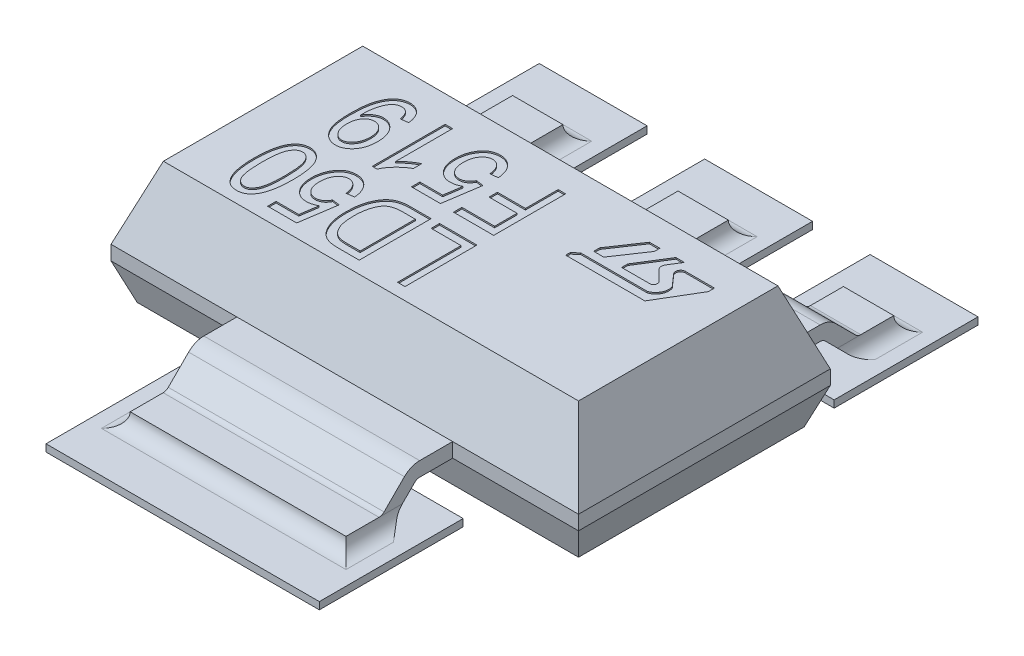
SolidWorks part; units mm, degrees
ref_plane "Plan de face" through (0, 0, 0) normal (0, 0, 1) x (1, 0, 0)
ref_plane "Plan de dessus" through (0, 0, 0) normal (0, 1, 0) x (1, 0, 0)
ref_plane "Plan de droite" through (0, 0, 0) normal (1, 0, 0) x (0, 0, -1)
sketch "Esquisse1" plane through (0, 0, 0) normal (0, 1, 0) x (1, 0, 0)
  line L1 (-3.25, 1.75) -> (3.25, 1.75)
  line L2 (-3.25, 1.75) -> (-3.25, -1.75)
  line L3 (-3.25, -1.75) -> (3.25, -1.75)
  line L4 (3.25, 1.75) -> (3.25, -1.75)
  point P4 (-3.25, 0)
  point P6 (0, -1.75)
  dimension "D1" = 3.5
  dimension "D2" = 6.5
extrude "Boss.-Extru.1" add sketch "Esquisse1" along normal blind 0.2
sketch "Esquisse2" plane through (3.25, 0, 0) normal (1, 0, 0) x (0, 0, -1)
  line L0 (-1.75, 0) -> (-1.568, -0.5)
  line L1 (-1.568, -0.5) -> (1.568, -0.5)
  line L2 (1.568, -0.5) -> (1.75, 0)
  line L3 (1.75, 0) -> (-1.75, 0)
  line L4 (-1.75, 0.2) -> (-1.386, 1.2)
  line L5 (-1.386, 1.2) -> (1.386, 1.2)
  line L6 (1.386, 1.2) -> (1.75, 0.2)
  line L7 (1.75, 0.2) -> (-1.75, 0.2)
  dimension "D1" = 0.5
  dimension "D2" = 1
  dimension "D3" = 70
  dimension "D4" = 70
extrude "Boss.-Extru.2" add sketch "Esquisse2" against normal up to surface (6.5 mm away)
sketch "Esquisse4" plane through (0, 0, -1.75) normal (0, 0, -1) x (-1, 0, 0)
  line L0 (-3.25, 0.2) -> (-2.886, 1.2)
  line L1 (3.25, 1.2) -> (-3.25, 1.2) construction
  line L2 (-2.886, 1.2) -> (-3.25, 1.2)
  line L3 (-3.25, 1.2) -> (-3.25, 0.2)
  line L4 (-3.25, 0) -> (-3.25, -0.5)
  line L5 (-3.25, -0.5) -> (-3.068, -0.5)
  line L6 (3.25, -0.5) -> (-3.25, -0.5) construction
  line L7 (-3.068, -0.5) -> (-3.25, 0)
  line L8 (-3.25, 0.2) -> (3.25, 0.2) construction
  line L9 (-3.25, 0) -> (3.25, 0) construction
  line L10 (3.25, 0.2) -> (2.886, 1.2)
  line L11 (2.886, 1.2) -> (3.25, 1.2)
  line L12 (3.25, 1.2) -> (3.25, 0.2)
  line L13 (3.25, 0) -> (3.25, -0.5)
  line L14 (3.25, -0.5) -> (3.068, -0.5)
  line L15 (3.068, -0.5) -> (3.25, 0)
  dimension "D1" = 70
  dimension "D2" = 70
  dimension "D3" = 70
  dimension "D4" = 70
extrude "Enlèv. mat.-Extru.1" cut sketch "Esquisse4" against normal through all
sketch "Esquisse5" plane through (0, 0, -1.75) normal (0, 0, -1) x (-1, 0, 0)
  line L0 (-3.25, 0.2) -> (3.25, 0.2) construction
  line L1 (-2.65, 0.2) -> (-1.95, 0.2)
  line L2 (-2.65, 0.2) -> (-2.65, 0)
  line L3 (-2.65, 0) -> (-1.95, 0)
  line L4 (-1.95, 0.2) -> (-1.95, 0)
  line L5 (-3.25, 0) -> (3.25, 0) construction
  line L7 (2.65, 0.2) -> (1.95, 0.2)
  line L8 (2.65, 0.2) -> (2.65, 0)
  line L9 (2.65, 0) -> (1.95, 0)
  line L10 (1.95, 0.2) -> (1.95, 0)
  line L11 (0.35, 0.2) -> (-0.35, 0.2)
  line L12 (0.35, 0.2) -> (0.35, 0)
  line L13 (0.35, 0) -> (-0.35, 0)
  line L14 (-0.35, 0.2) -> (-0.35, 0)
  point P16 (0, 0.2)
  dimension "D1" = 0.7
  dimension "D2" = 1.6
  dimension "D3" = 1.6
extrude "Boss.-Extru.3" add sketch "Esquisse5" along normal blind 0.5
sketch "Esquisse6" plane through (0, 0, 1.75) normal (0, 0, 1) x (1, 0, 0)
  line L0 (-3.25, 0.2) -> (3.25, 0.2) construction
  line L1 (-1.5, 0.2) -> (1.5, 0.2)
  line L2 (-1.5, 0.2) -> (-1.5, 0)
  line L3 (-1.5, 0) -> (1.5, 0)
  line L4 (1.5, 0.2) -> (1.5, 0)
  line L5 (-3.25, 0) -> (3.25, 0) construction
  point P8 (0, 0.2)
  dimension "D1" = 3
extrude "Boss.-Extru.4" add sketch "Esquisse6" along normal blind 0.5
sketch "Esquisse7" plane through (2.65, 0, 0) normal (1, 0, 0) x (0, 0, -1)
  line L0 (2.25, 0) -> (2.5621, -0.3121)
  line L1 (2.7743, -0.4) -> (3.2328, -0.4)
  line L2 (3.2328, -0.4) -> (3.2328, -0.2)
  line L3 (3.2328, -0.2) -> (2.7328, -0.2)
  line L4 (2.7328, -0.2) -> (2.3328, 0.2)
  line L5 (2.3328, 0.2) -> (2.25, 0.2)
  line L6 (2.25, 0.2) -> (2.25, 0)
  line L7 (-1.568, -0.5) -> (1.568, -0.5) construction
  arc A0 (2.5621, -0.3121) -> (2.7743, -0.4) centre (2.7743, -0.1) ccw
  dimension "D6" = 0.3
  dimension "D1" = 135
  dimension "D2" = 0.2
  dimension "D3" = 0.2
  dimension "D4" = 0.5
  dimension "D5" = 0.1
extrude "Boss.-Extru.5" add sketch "Esquisse7" against normal blind 0.7
sketch "Esquisse8" plane through (1.5, 0, 0) normal (1, 0, 0) x (0, 0, -1)
  line L0 (-2.25, 0) -> (-2.5621, -0.3121)
  line L1 (-2.7743, -0.4) -> (-3.2328, -0.4)
  line L2 (-3.2328, -0.4) -> (-3.2328, -0.2)
  line L3 (-3.2328, -0.2) -> (-2.7328, -0.2)
  line L4 (-2.7328, -0.2) -> (-2.3328, 0.2)
  line L5 (-2.3328, 0.2) -> (-2.25, 0.2)
  line L6 (-2.25, 0.2) -> (-2.25, 0)
  line L7 (-1.568, -0.5) -> (1.568, -0.5) construction
  arc A0 (-2.7743, -0.4) -> (-2.5621, -0.3121) centre (-2.7743, -0.1) ccw
  dimension "D6" = 0.3
  dimension "D1" = 135
  dimension "D2" = 0.5
  dimension "D3" = 0.2
  dimension "D4" = 0.2
  dimension "D5" = 0.1
extrude "Boss.-Extru.6" add sketch "Esquisse8" against normal blind 3
pattern_linear "Répétition linéaire1" count 3 spacing 2.3 along (-1, 0, 0) of "Boss.-Extru.5"
sketch "Esquisse9" plane through (0, -0.4, 0) normal (0, -1, 0) x (1, 0, 0)
  line L0 (-2.65, -3.0036) -> (-1.95, -3.0036) construction
  line L1 (-3.05, -4.0036) -> (-1.55, -4.0036)
  line L2 (-3.05, -4.0036) -> (-3.05, -2.0036)
  line L3 (-3.05, -2.0036) -> (-1.55, -2.0036)
  line L4 (-1.55, -4.0036) -> (-1.55, -2.0036)
  line L5 (-2.65, -2.7743) -> (-2.65, -3.2328) construction
  line L6 (-1.95, -2.7743) -> (-1.95, -3.2328) construction
  line L7 (-2.65, -3.2328) -> (-3.05, -4.0036) construction
  line L8 (-1.95, -3.2328) -> (-1.55, -4.0036) construction
  line L9 (-1.5, 3.0036) -> (1.5, 3.0036) construction
  line L10 (-1.9, 4.0036) -> (1.9, 4.0036)
  line L11 (-1.9, 4.0036) -> (-1.9, 2.0036)
  line L12 (-1.9, 2.0036) -> (1.9, 2.0036)
  line L13 (1.9, 4.0036) -> (1.9, 2.0036)
  line L14 (-1.5, 3.2328) -> (-1.5, 2.7743) construction
  line L15 (1.5, 3.2328) -> (1.5, 2.7743) construction
  line L16 (-1.5, 3.2328) -> (-1.9, 4.0036) construction
  line L17 (1.5, 3.2328) -> (1.9, 4.0036) construction
  line L18 (-0.35, -3.2328) -> (-0.75, -4.0036) construction
  line L19 (-0.75, -2.0036) -> (0.75, -2.0036)
  line L20 (-0.75, -2.0036) -> (-0.75, -4.0036)
  line L21 (-0.75, -4.0036) -> (0.75, -4.0036)
  line L22 (0.75, -2.0036) -> (0.75, -4.0036)
  line L23 (1.55, -2.0036) -> (3.05, -2.0036)
  line L24 (1.55, -2.0036) -> (1.55, -4.0036)
  line L25 (1.55, -4.0036) -> (3.05, -4.0036)
  line L26 (3.05, -2.0036) -> (3.05, -4.0036)
  line L27 (1.95, -3.2328) -> (1.55, -4.0036) construction
  point P10 (-3.05, -3.0036)
  point P25 (-1.9, 3.0036)
  dimension "D1" = 2
  dimension "D2" = 1.5
  dimension "D3" = 3.8
  dimension "D4" = 2
extrude "Boss.-Extru.7" add sketch "Esquisse9" along normal blind 0.1
fillet "Congé1" radius 0.1 8 edges at (-2.3, -0.2, -2.7328) (0, -0.2, -2.7328) (2.3, -0.2, -2.7328) (2.3, 0, -2.25) (0, 0, -2.25) (-2.3, 0, -2.25) (0, 0, 2.25) (0, -0.2, 2.7328)
fillet "Congé2" radius 0.3 4 edges at (0, 0.2, 2.3328) (-2.3, 0.2, -2.3328) (0, 0.2, -2.3328) (2.3, 0.2, -2.3328)
fillet "Congé3" radius 0.2 3 edges at (1.5, -0.4, 3.0036) (0, -0.4, 3.2328) (-1.5, -0.4, 3.0036)
fillet "Congé4" radius 0.2 9 edges at (-2.65, -0.4, -3.0036) (-0.35, -0.4, -3.0036) (1.95, -0.4, -3.0036) (-2.3, -0.4, -3.2328) (-1.95, -0.4, -3.0036) (0, -0.4, -3.2328) (0.35, -0.4, -3.0036) (2.3, -0.4, -3.2328) (2.65, -0.4, -3.0036)
sketch "Esquisse10" plane through (0, 1.2, 0) normal (0, 1, 0) x (1, 0, 0)
  line L0 (15.2989, 30.535) -> (73.2989, 30.535) construction
  line L1 (1.8539, 0.8572) -> (1.9543, 1.0176)
  line L2 (1.9543, 1.0176) -> (1.836, 1.0176)
  line L3 (1.836, 1.0176) -> (1.5785, 0.6059)
  line L4 (1.5785, 0.6059) -> (1.5785, 0.5206)
  line L5 (1.5785, 0.5206) -> (1.9675, 0.5206)
  line L6 (2.0055, 0.6135) -> (1.8668, 0.7494)
  line L7 (1.6136, 1.0176) -> (1.4676, 1.0176)
  line L8 (1.4676, 1.0176) -> (1.1897, 0.6059)
  line L9 (1.1897, 0.6059) -> (1.1897, 0.5206)
  line L10 (1.1897, 0.5206) -> (1.3295, 0.5206)
  line L11 (1.3295, 0.5206) -> (1.6136, 0.9416)
  line L12 (1.6136, 0.9416) -> (1.6136, 1.0176)
  line L13 (2.472, 0.9174) -> (2.0689, 0.9174)
  line L14 (2.0178, 0.8047) -> (2.1618, 0.6404)
  line L15 (2.0423, 0.4116) -> (1.1191, 0.4116)
  line L16 (1.1191, 0.4116) -> (1.0414, 0.3435)
  line L17 (1.0414, 0.3435) -> (1.0414, 0.2795)
  line L18 (1.0414, 0.2795) -> (2.1433, 0.2795)
  line L19 (2.1433, 0.2795) -> (2.472, 0.8323)
  line L20 (2.472, 0.8323) -> (2.472, 0.9174)
  line L21 (0.3938, 1.0176) -> (-2.5326, 1.0176) construction
  line L22 (0.3938, -0.2155) -> (-2.4066, -0.2155) construction
  arc A0 (1.8539, 0.8572) -> (1.8668, 0.7494) centre (1.9274, 0.8113) ccw
  arc A1 (2.0055, 0.6135) -> (1.9675, 0.5206) centre (1.9675, 0.5748) cw
  arc A2 (2.0689, 0.9174) -> (2.0178, 0.8047) centre (2.0689, 0.8494) ccw
  arc A3 (2.1618, 0.6404) -> (2.0423, 0.4116) centre (1.9876, 0.5857) cw
  text T0 "F519" font "Arial Narrow" height 1
  text T1 "LD50" font "Arial Narrow" height 1
extrude "Enlèv. mat.-Extru.2" cut sketch "Esquisse10" against normal blind 0.02
